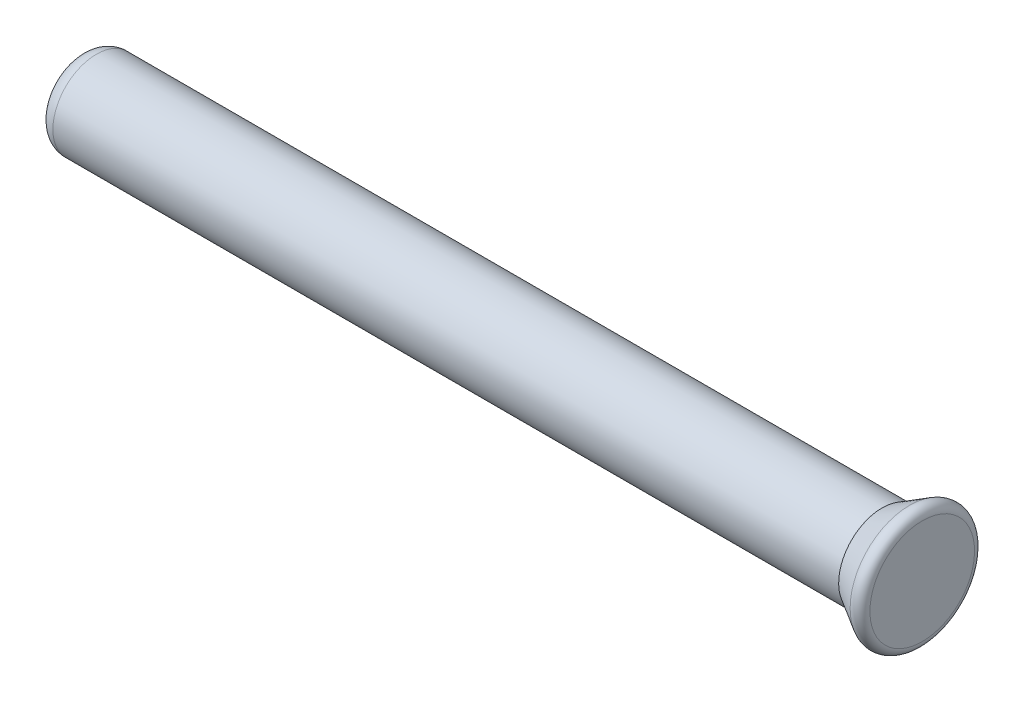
SolidWorks part; units mm, degrees
ref_plane "Plan de face" through (0, 0, 0) normal (0, 0, 1) x (1, 0, 0)
ref_plane "Plan de dessus" through (0, 0, 0) normal (0, 1, 0) x (1, 0, 0)
ref_plane "Plan de droite" through (0, 0, 0) normal (1, 0, 0) x (0, 0, -1)
sketch "Esquisse1" plane through (0, 0, 0) normal (0, 0, 1) x (1, 0, 0)
  line L0 (-12.6, 0.65) -> (-0.6, 0.65)
  line L1 (-0.6, 0.65) -> (0, 1)
  line L2 (0, 1) -> (0, 0)
  line L3 (0, 0) -> (-12.6, 0)
  line L4 (-12.6, 0.65) -> (-12.6, 0)
  line L5 (0, 0) -> (-12.6, 0) construction
  dimension "D1" = 1.3
  dimension "D2" = 2
  dimension "D3" = 0.6
  dimension "D4" = 12
revolve "Révolution1" add sketch "Esquisse1" angle 360 about L5
fillet "Congé1" radius 0.25 1 edges at (-12.6, 0.65, 0)
fillet "Congé2" radius 0.125 1 edges at (0, 1, 0)
